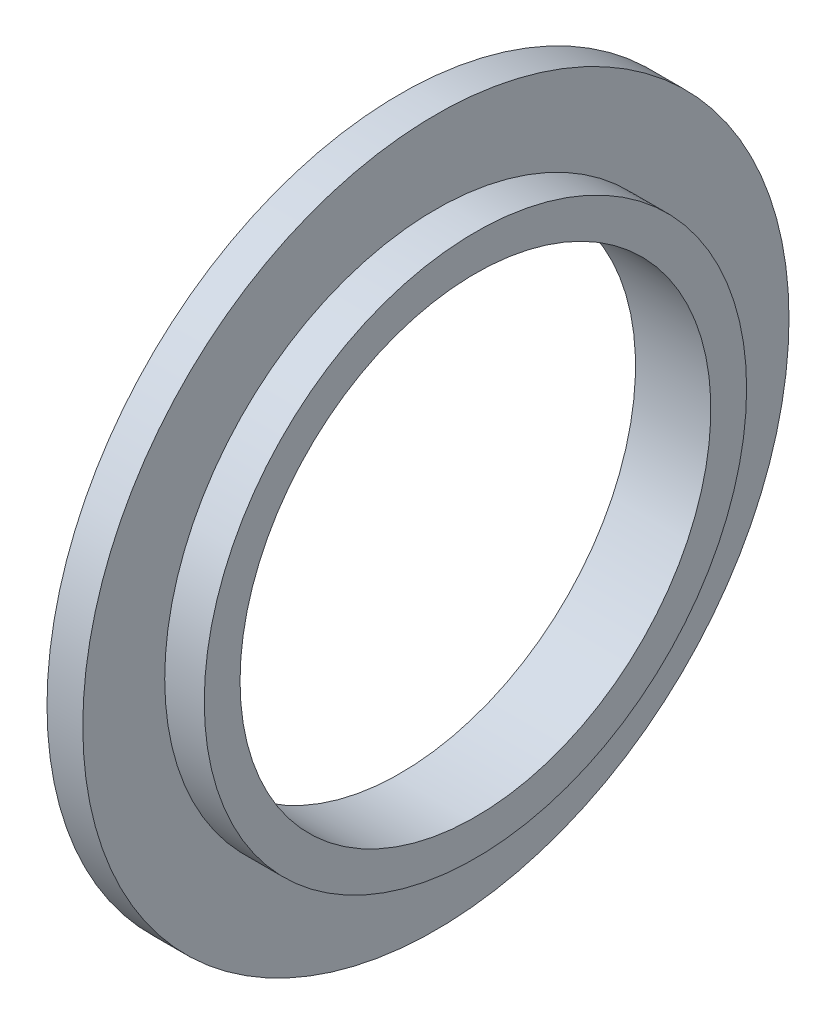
SolidWorks part; units mm, degrees
ref_plane "Plan1" through (0, 0, 0) normal (0, 0, 1) x (1, 0, 0)
ref_plane "Plan2" through (0, 0, 0) normal (0, 1, 0) x (1, 0, 0)
ref_plane "Plan3" through (0, 0, 0) normal (1, 0, 0) x (0, 0, -1)
sketch "Esquisse1" plane through (0, 0, 0) normal (0, 0, 1) x (1, 0, 0)
  line L0 (-20, 0) -> (70, 0) construction
  line L1 (0, 25) -> (0, 37.5)
  line L2 (0, 25) -> (8, 25)
  dimension "D1" = 25
  dimension "D2" = 37.5
  dimension "D3" = 8
revolve "Base-Révol.-Mince" add sketch "Esquisse1" angle 360 about L0
